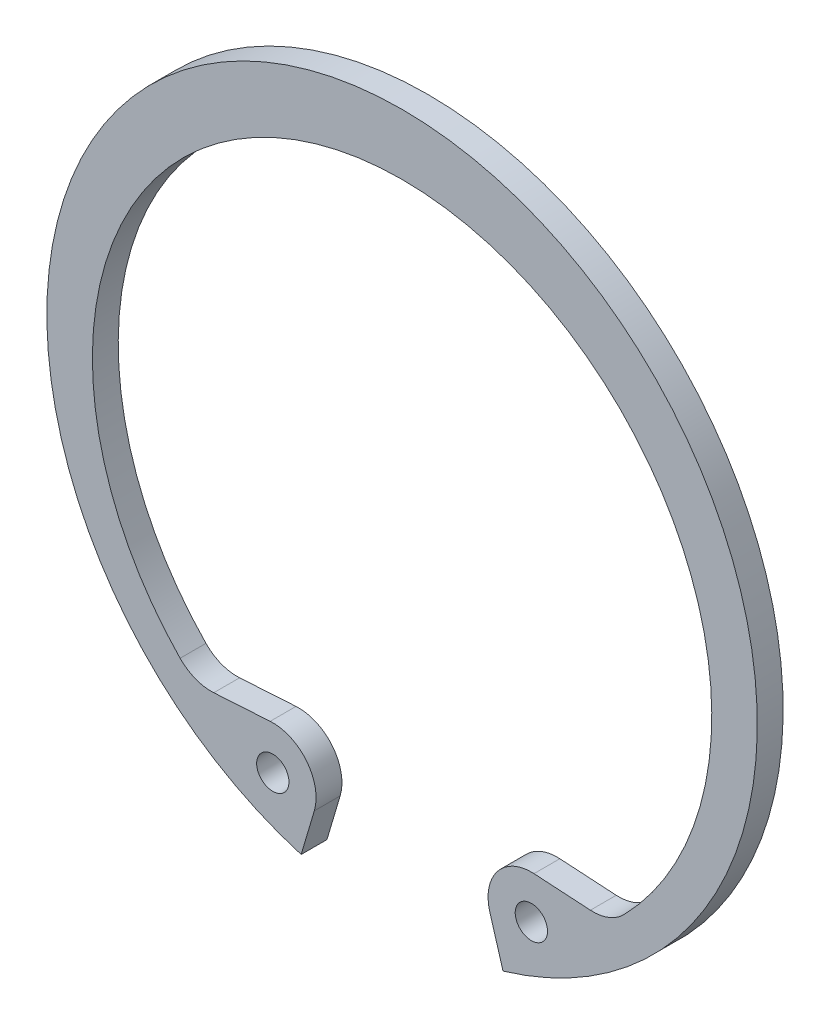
SolidWorks part; units mm, degrees
ref_plane "Face" through (0, 0, 0) normal (0, 0, 1) x (1, 0, 0)
ref_plane "Dessus" through (0, 0, 0) normal (0, 1, 0) x (1, 0, 0)
ref_plane "Droite" through (0, 0, 0) normal (1, 0, 0) x (0, 0, -1)
sketch "Esquisse1" plane through (0, 0, 0) normal (0, 0, 1) x (1, 0, 0)
  line L0 (0, 22.8) -> (0, 27.5) construction
  line L1 (6.7963, -22.9306) -> (7.8146, -26.3663)
  line L2 (8.6199, -18.9298) -> (11.3965, -25.0274) construction
  line L3 (14.579, -18.9012) -> (10.2122, -18.6348)
  line L4 (-14.579, -18.9012) -> (-10.2122, -18.6348)
  line L5 (-6.7963, -22.9306) -> (-7.8146, -26.3663)
  line L6 (8.3851, -23.038) -> (9.6108, -26.4054) construction
  line L7 (-8.3851, -23.038) -> (-9.6108, -26.4054) construction
  arc A0 (7.8146, -26.3663) -> (-7.8146, -26.3663) centre (0, 0) ccw
  arc A1 (17.1841, -17.8935) -> (-17.1841, -17.8935) centre (0, -1.175) ccw
  arc A2 (10.2122, -18.6348) -> (6.7963, -22.9306) centre (10.0082, -21.9786) ccw
  arc A3 (14.579, -18.9012) -> (17.1841, -17.8935) centre (14.783, -15.5574) ccw
  circle A4 centre (10.0082, -21.9786) radius 1.25
  arc A5 (-14.579, -18.9012) -> (-17.1841, -17.8935) centre (-14.783, -15.5574) cw
  circle A6 centre (-10.0082, -21.9786) radius 1.25
  arc A7 (-10.2122, -18.6348) -> (-6.7963, -22.9306) centre (-10.0082, -21.9786) cw
  arc A8 (9.6108, -26.4054) -> (-9.6108, -26.4054) centre (0, 0) ccw construction
  circle A9 centre (0, 0) radius 26 construction
  dimension "dgorge" = 55
  dimension "D3" = 1.175
  dimension "dtrou" = 2.5
  dimension "dext" = 56.2
  dimension "dn" = 52
  dimension "b" = 4.7
  dimension "a" = 6.7
  dimension "D5" = 70
  dimension "D7" = 33.018
  dimension "D9" = 40
extrude "Base-Extrusion" add sketch "Esquisse1" along normal blind 2
equation "\"D3@Esquisse1\" = \"b@Esquisse1\"/4"
equation "\"D7@Esquisse1\" = 360-(360-\"D9@Esquisse1\")*\"dext@Esquisse1\"/\"dgorge@Esquisse1\""
